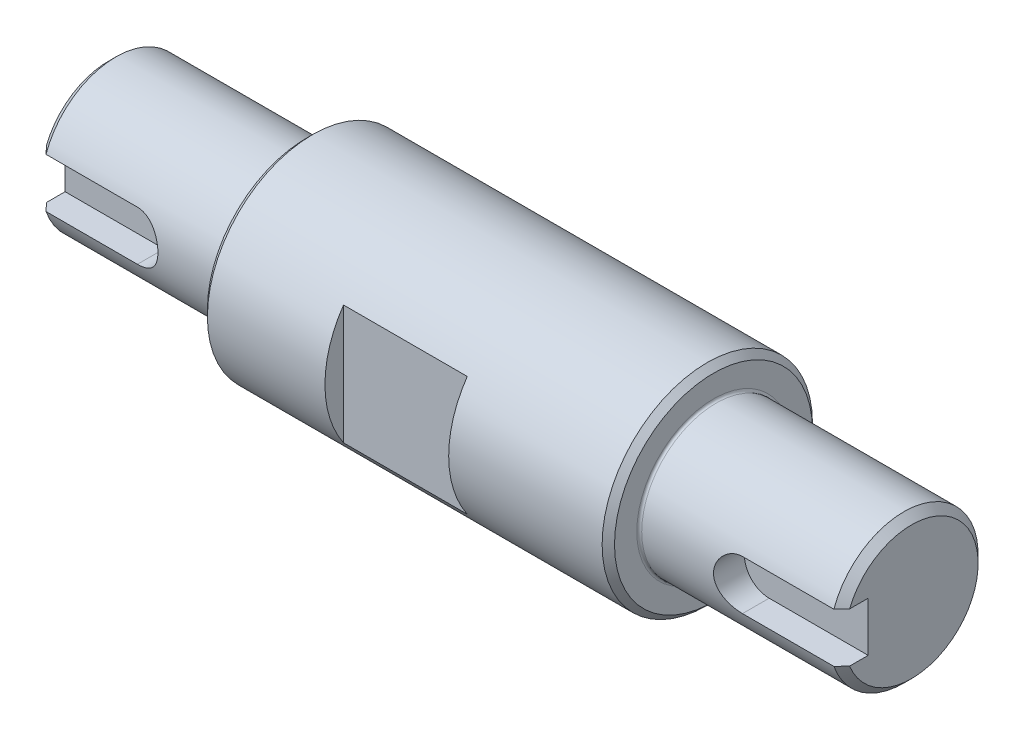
SolidWorks part; units mm, degrees
ref_plane "Front X-Y" through (0, 0, 0) normal (0, 0, 1) x (1, 0, 0)
ref_plane "Top X-Z" through (0, 0, 0) normal (0, 1, 0) x (1, 0, 0)
ref_plane "Right Y-Z" through (0, 0, 0) normal (1, 0, 0) x (0, 0, -1)
ref_plane "Plane1" through (0, 0, 0) normal (0, 0, 1) x (1, 0, 0)
sketch "Sketch1" plane through (0, 0, 0) normal (0, 0, 1) x (1, 0, 0)
  line L0 (-16, 0) -> (-16, 5.3865)
  line L1 (-16, 5.3865) -> (-15.3865, 6)
  line L2 (-15.3865, 6) -> (-0.2, 6)
  line L3 (0, 6.2) -> (0, 8)
  line L4 (0, 8) -> (0.5, 8.5)
  line L5 (0.5, 8.5) -> (32.4, 8.5)
  line L6 (32.4, 8.5) -> (32.9, 8)
  line L7 (32.9, 8) -> (32.9, 6.2)
  line L8 (33.1, 6) -> (48.2865, 6)
  line L9 (48.2865, 6) -> (48.9, 5.3865)
  line L10 (48.9, 5.3865) -> (48.9, 0)
  line L11 (48.9, 0) -> (-16, 0)
  line L12 (48.9, 0) -> (-16, 0) construction
  arc A0 (-0.2, 6) -> (0, 6.2) centre (-0.2, 6.2) ccw
  arc A1 (32.9, 6.2) -> (33.1, 6) centre (33.1, 6.2) ccw
revolve "Revolve1" add sketch "Sketch1" angle 360 about L12
ref_plane "Plane2" through (10, 0, 0) normal (1, 0, 0) x (0, 0, -1)
sketch "Sketch2" plane through (10, 0, 0) normal (1, 0, 0) x (0, 0, -1)
  line L0 (-14, 8.5) -> (-14, -17)
  line L1 (-14, -17) -> (14, -17)
  line L2 (14, -17) -> (14, 8.5)
  line L3 (14, 8.5) -> (7, 8.5)
  line L4 (7, 8.5) -> (7, -8.5)
  line L5 (7, -8.5) -> (-7, -8.5)
  line L6 (-7, -8.5) -> (-7, 8.5)
  line L7 (-7, 8.5) -> (-14, 8.5)
extrude "Cut-Extrude1" cut sketch "Sketch2" along normal blind 10
ref_plane "Plane3" through (0, 0, 6) normal (0, 0, 1) x (1, 0, 0)
sketch "Sketch3" plane through (0, 0, 6) normal (0, 0, 1) x (1, 0, 0)
  line L0 (-17, -2) -> (-8, -2)
  line L1 (-8, 2) -> (-17, 2)
  line L2 (-17, 2) -> (-17, -2)
  arc A0 (-8, -2) -> (-8, 2) centre (-8, 0) ccw
extrude "Cut-Extrude2" cut sketch "Sketch3" against normal blind 2.5
ref_plane "Plane4" through (0, 0, 6) normal (0, 0, 1) x (1, 0, 0)
sketch "Sketch4" plane through (0, 0, 6) normal (0, 0, 1) x (1, 0, 0)
  line L0 (40.9, -2) -> (49.9, -2)
  line L1 (49.9, -2) -> (49.9, 2)
  line L2 (49.9, 2) -> (40.9, 2)
  arc A0 (40.9, 2) -> (40.9, -2) centre (40.9, 0) ccw
extrude "Cut-Extrude3" cut sketch "Sketch4" against normal blind 2.5
